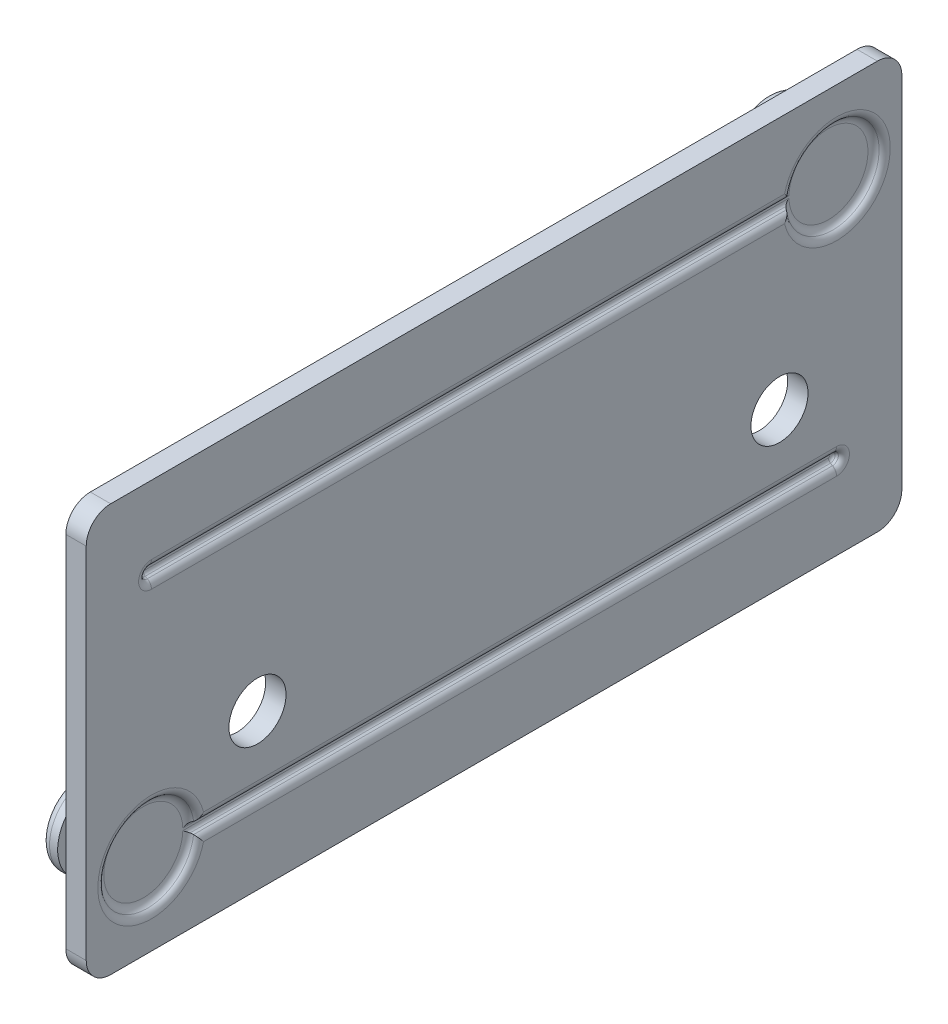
SolidWorks part; units mm, degrees
ref_plane "Front" through (0, 0, 0) normal (0, 0, 1) x (1, 0, 0)
ref_plane "Top" through (0, 0, 0) normal (0, 1, 0) x (1, 0, 0)
ref_plane "Right" through (0, 0, 0) normal (1, 0, 0) x (0, 0, -1)
sketch "Sketch2"
  dimension "D1" = 100
  dimension "D2" = 50
extrude "Extrude1" add sketch "Sketch2" along normal blind 2.5
sketch "Sketch3"
  dimension "D1" = 2
  dimension "D3" = 7
  dimension "D10" = 2
  dimension "D9" = 7
  dimension "D13" = 2
  dimension "D2" = 2
  dimension "D4" = 8
  dimension "D5" = 8
  dimension "D6" = 8
  dimension "D7" = 8
  dimension "D8" = 10
  dimension "D11" = 2
  dimension "D12" = 10
extrude "Extrude2" add sketch "Sketch3" along normal blind 1 draft 30
fillet "Fillet1" radius 1.5 8 edges at (-1, 41.4226, 53.1316) (-1, 40, 93.4226) (-1, 38.5774, 53.1316) (-1, 40, 1.5774) (-1, 8.5774, 46.8684) (-1, 10, 6.5774) (-1, 11.4226, 46.8684) (-1, 10, 98.4226)
sketch "Sketch4"
extrude "Cut-Extrude1" cut sketch "Sketch4" against normal blind 1 draft 30
fillet "Fillet2" radius 1 8 edges at (2.5, 11, 47.042) (2.5, 10, 7) (2.5, 41, 52.958) (2.5, 40, 93) (2.5, 10, 98) (2.5, 9, 47.042) (2.5, 40, 2) (2.5, 39, 52.958)
fillet "Fillet3" radius 1 2 edges at (1.5, 10, 97.4226) (1.5, 40, 2.5774)
fillet "Fillet4" radius 0.5 6 edges at (1.5, 9.5774, 47.5866) (1.5, 10, 7.5774) (1.5, 39.5774, 52.4134) (1.5, 40, 92.4226) (1.5, 10.4226, 47.5866) (1.5, 40.4226, 52.4134)
fillet "Fillet5" radius 3 4 edges at (1.25, 0, 100) (1.25, 50, 100) (1.25, 0, 0) (1.25, 50, 0)
sketch "Sketch5"
  dimension "D1" = 5
  dimension "D2" = 5
extrude "Extrude3" add sketch "Sketch5" along normal blind 3
sketch "Sketch6"
  dimension "D1" = 10
  dimension "D2" = 10
extrude "Extrude4" add sketch "Sketch6" along normal blind 2
fillet "Fillet6" radius 1 2 edges at (-6, 10, 97) (-6, 40, 13)
sketch "Sketch7"
  dimension "D1" = 21
  dimension "D2" = 64
  dimension "D3" = 19
hole_wizard "M7.0 (7) Diameter Hole1" positions "3DSketch1" profile "Sketch8" hole size "M7.0" standard "Ansi Metric"
sketch3d "3DSketch1"
sketch "Sketch8"
  dimension "Thru Hole Dia." = 7
  dimension "Thru Hole Depth" = 2.501
